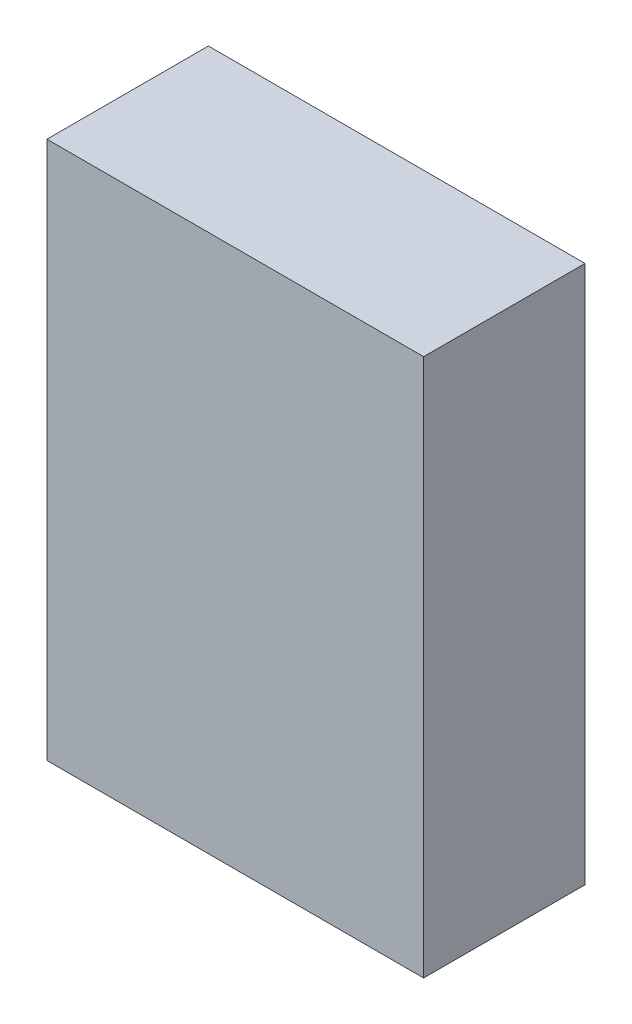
SolidWorks part; units mm, degrees
ref_plane "Front Plane" through (0, 0, 0) normal (0, 0, 1) x (1, 0, 0)
ref_plane "Top Plane" through (0, 0, 0) normal (0, 1, 0) x (1, 0, 0)
ref_plane "Right Plane" through (0, 0, 0) normal (1, 0, 0) x (0, 0, -1)
sketch "Sketch1" plane through (0, 0, 0) normal (0, 1, 0) x (1, 0, 0)
  line L1 (-44.45, 19.05) -> (44.45, 19.05)
  line L2 (-44.45, 19.05) -> (-44.45, -19.05)
  line L3 (-44.45, -19.05) -> (44.45, -19.05)
  line L4 (44.45, 19.05) -> (44.45, -19.05)
  line L5 (-44.45, 19.05) -> (44.45, -19.05) construction
  line L6 (-44.45, -19.05) -> (44.45, 19.05) construction
  point P0 (0, 0)
  dimension "D1" = 88.9
  dimension "D2" = 38.1
extrude "Boss-Extrude1" add sketch "Sketch1" along normal blind 127
